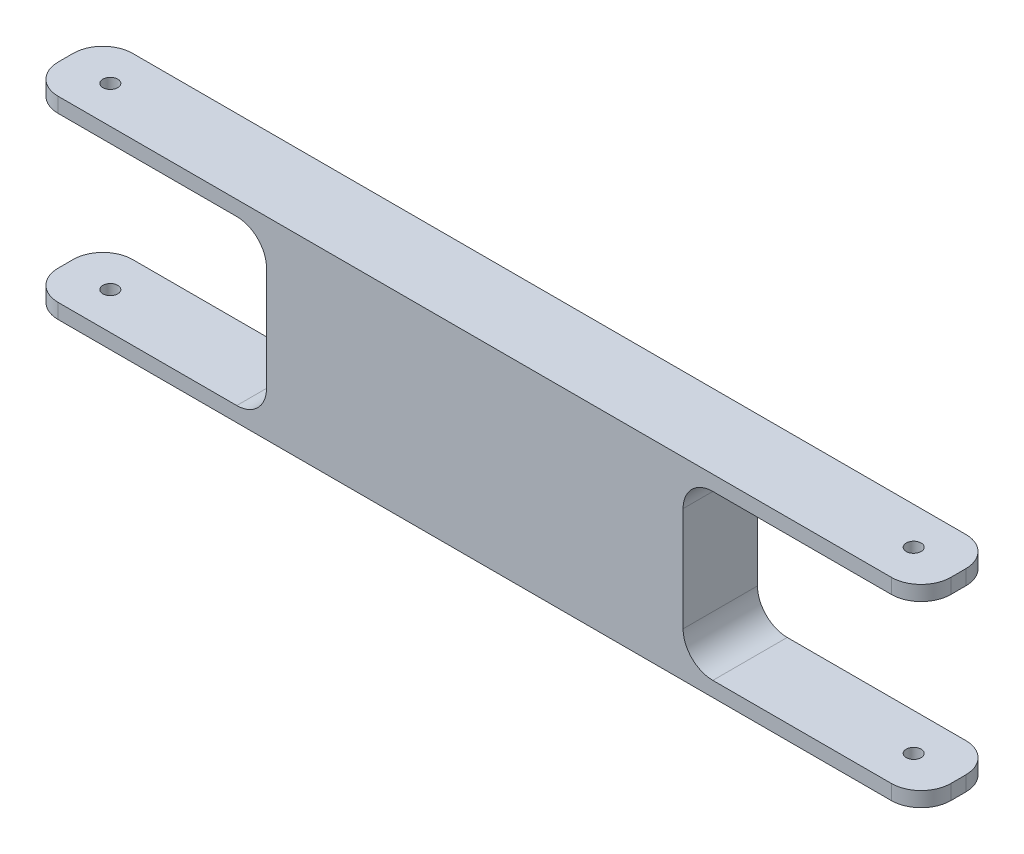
SolidWorks part; units mm, degrees
ref_plane "前视基准面" through (0, 0, 0) normal (0, 0, 1) x (1, 0, 0)
ref_plane "上视基准面" through (0, 0, 0) normal (0, 1, 0) x (1, 0, 0)
ref_plane "右视基准面" through (0, 0, 0) normal (1, 0, 0) x (0, 0, -1)
other "Configuration Table"
sketch "草图1" plane through (0, 0, 0) normal (0, 0, 1) x (1, 0, 0)
  line L1 (150, -32.5) -> (-150, -32.5)
  line L2 (150, -32.5) -> (150, 32.5)
  line L3 (150, 32.5) -> (-150, 32.5)
  line L4 (-150, -32.5) -> (-150, 32.5)
  line L5 (150, -32.5) -> (-150, 32.5) construction
  line L6 (150, 32.5) -> (-150, -32.5) construction
  point P0 (0, 0)
  dimension "D1" = 300
  dimension "D2" = 65
extrude "凸台-拉伸1" add sketch "草图1" along normal blind 25
sketch "草图2" plane through (0, 0, 25) normal (0, 0, 1) x (1, 0, 0)
  line L0 (150, -32.5) -> (150, 32.5) construction
  line L1 (150, 27.5) -> (70, 27.5)
  line L2 (150, 27.5) -> (150, -27.5)
  line L3 (150, -27.5) -> (70, -27.5)
  line L4 (70, 27.5) -> (70, -27.5)
  line L6 (-73.3018, 0) -> (76.0421, 0) construction
  line L7 (0, 43.63) -> (0, -40.4616) construction
  line L8 (-150, -27.5) -> (-70, -27.5)
  line L9 (-70, 27.5) -> (-70, -27.5)
  line L10 (-150, 27.5) -> (-70, 27.5)
  line L11 (-150, 27.5) -> (-150, -27.5)
  dimension "D1" = 55
  dimension "D2" = 80
  dimension "D3" = 27.5
extrude "切除-拉伸1" cut sketch "草图2" against normal blind 30
fillet "圆角1" radius 10 4 edges at (70, -27.5, 12.5) (-70, -27.5, 12.5) (70, 27.5, 12.5) (-70, 27.5, 12.5)
fillet "圆角2" radius 10 8 edges at (150, 30, 0) (150, 30, 25) (150, -30, 0) (150, -30, 25) (-150, 30, 25) (-150, 30, 0) (-150, -30, 0) (-150, -30, 25)
sketch "草图3" plane through (0, -32.5, 0) normal (0, -1, 0) x (1, 0, 0)
  line L2 (-140, 0) -> (140, 0) construction
  line L3 (0, 38.3122) -> (0, -12.1854) construction
  circle A0 centre (135, 12.5) radius 2.5
  circle A1 centre (-135, 12.5) radius 2.5
  dimension "D1" = 12.5
  dimension "D2" = 135
extrude "切除-拉伸3" cut sketch "草图3" against normal through all
